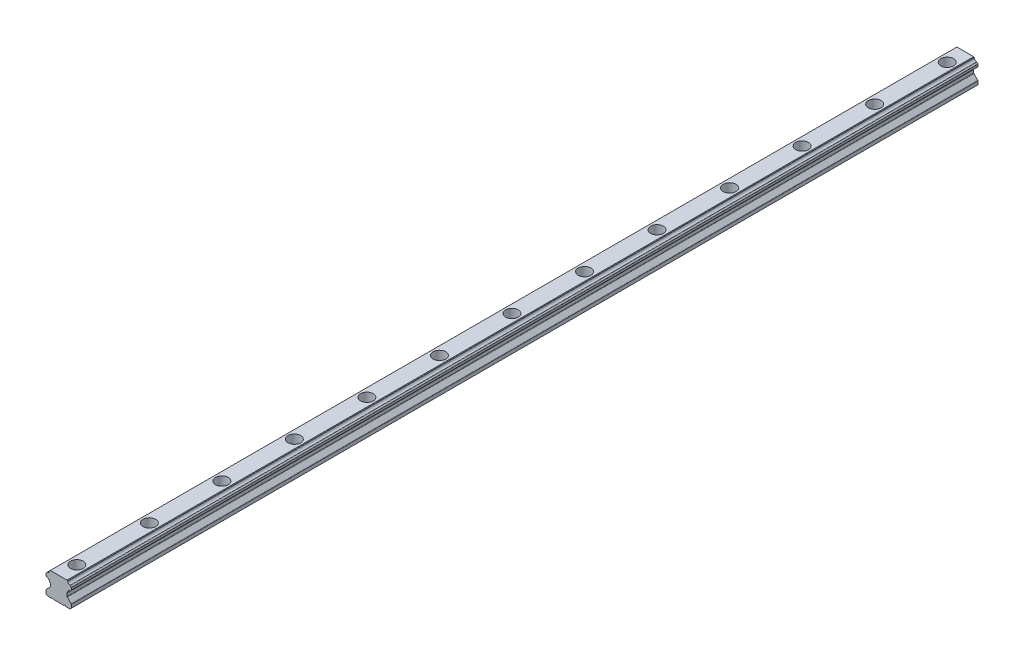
SolidWorks part; units mm, degrees
ref_plane "Front Plane" through (0, 0, 0) normal (0, 0, 1) x (1, 0, 0)
ref_plane "Top Plane" through (0, 0, 0) normal (0, 1, 0) x (1, 0, 0)
ref_plane "Right Plane" through (0, 0, 0) normal (1, 0, 0) x (0, 0, -1)
sketch "Sketch2" plane through (0, 0, 0) normal (0, 0, 1) x (1, 0, 0)
  line L0 (12.8558, 4.6786) -> (13.9571, 5.7799)
  line L1 (14.1328, 6.2042) -> (14.1328, 8.2246)
  line L2 (13.9571, 8.6489) -> (12.8494, 9.7566)
  line L3 (9.8814, 12.7246) -> (9.3887, 13.2173)
  line L4 (9.3887, 13.2173) -> (-9.123, 13.2173)
  line L5 (-9.123, 13.2173) -> (-9.6158, 12.7246)
  line L6 (-12.5837, 9.7566) -> (-13.6914, 8.6489)
  line L7 (-13.8672, 8.2246) -> (-13.8672, 6.2042)
  line L8 (-13.6914, 5.7799) -> (-12.5901, 4.6786)
  line L9 (-9.615, 1.7034) -> (-9.4015, 1.49)
  line L10 (-9.1672, 0.9243) -> (-9.1672, -2.3102)
  line L11 (-9.4015, -2.8759) -> (-13.6328, -7.1073)
  line L12 (-13.8672, -7.6729) -> (-13.8672, -11.2827)
  line L13 (-13.8672, -11.2827) -> (-12.3672, -12.7827)
  line L14 (-12.3672, -12.7827) -> (-7.6172, -12.7827)
  line L15 (-7.6172, -12.7827) -> (-7.1172, -12.2827)
  line L16 (-7.1172, -12.2827) -> (-5.9172, -12.2827)
  line L17 (-5.9172, -12.2827) -> (-5.4172, -12.7827)
  line L18 (-5.4172, -12.7827) -> (5.6828, -12.7827)
  line L19 (5.6828, -12.7827) -> (6.1828, -12.2827)
  line L20 (6.1828, -12.2827) -> (7.3828, -12.2827)
  line L21 (7.3828, -12.2827) -> (7.8828, -12.7827)
  line L22 (7.8828, -12.7827) -> (12.6328, -12.7827)
  line L23 (12.6328, -12.7827) -> (14.1328, -11.2827)
  line L24 (14.1328, -11.2827) -> (14.1328, -7.6729)
  line L25 (13.8985, -7.1073) -> (9.6672, -2.8759)
  line L26 (9.4328, -2.3102) -> (9.4328, 0.9243)
  line L27 (9.6672, 1.49) -> (9.8806, 1.7034)
  arc A0 (12.5064, 4.5076) -> (12.8558, 4.6786) centre (12.4315, 5.1029) ccw
  arc A1 (13.9571, 5.7799) -> (14.1328, 6.2042) centre (13.5328, 6.2042) ccw
  arc A2 (14.1328, 8.2246) -> (13.9571, 8.6489) centre (13.5328, 8.2246) ccw
  arc A3 (12.8494, 9.7566) -> (12.5011, 9.9275) centre (12.4251, 9.3323) ccw
  arc A4 (10.0523, 12.3763) -> (12.5011, 9.9275) centre (12.8596, 12.7347) ccw
  arc A5 (10.0523, 12.3763) -> (9.8814, 12.7246) centre (9.4572, 12.3003) ccw
  arc A6 (-9.6158, 12.7246) -> (-9.7867, 12.3763) centre (-9.1915, 12.3003) ccw
  arc A7 (-12.2354, 9.9275) -> (-9.7867, 12.3763) centre (-12.5939, 12.7347) ccw
  arc A8 (-12.2354, 9.9275) -> (-12.5837, 9.7566) centre (-12.1595, 9.3323) ccw
  arc A9 (-13.6914, 8.6489) -> (-13.8672, 8.2246) centre (-13.2672, 8.2246) ccw
  arc A10 (-13.8672, 6.2042) -> (-13.6914, 5.7799) centre (-13.2672, 6.2042) ccw
  arc A11 (-12.5901, 4.6786) -> (-12.2407, 4.5076) centre (-12.1659, 5.1029) ccw
  arc A12 (-9.786, 2.0528) -> (-12.2407, 4.5076) centre (-12.5939, 1.6997) ccw
  arc A13 (-9.786, 2.0528) -> (-9.615, 1.7034) centre (-9.1907, 2.1277) ccw
  arc A14 (-9.1672, 0.9243) -> (-9.4015, 1.49) centre (-9.9672, 0.9243) ccw
  arc A15 (-9.4015, -2.8759) -> (-9.1672, -2.3102) centre (-9.9672, -2.3102) ccw
  arc A16 (-13.6328, -7.1073) -> (-13.8672, -7.6729) centre (-13.0672, -7.6729) ccw
  arc A17 (14.1328, -7.6729) -> (13.8985, -7.1073) centre (13.3328, -7.6729) ccw
  arc A18 (9.4328, -2.3102) -> (9.6672, -2.8759) centre (10.2328, -2.3102) ccw
  arc A19 (9.6672, 1.49) -> (9.4328, 0.9243) centre (10.2328, 0.9243) ccw
  arc A20 (9.8806, 1.7034) -> (10.0517, 2.0528) centre (9.4564, 2.1277) ccw
  arc A21 (12.5064, 4.5076) -> (10.0517, 2.0528) centre (12.8596, 1.6997) ccw
extrude "Boss-Extrude1" add sketch "Sketch2" along normal blind 1000
sketch "Sketch3" plane through (0, 13.2173, 0) normal (0, 1, 0) x (1, 0, 0)
  line L0 (9.3887, 0) -> (-9.123, 0) construction
  line L1 (14.1328, -1000) -> (14.1328, 0) construction
  point P0 (0.1328, -20)
  dimension "D1" = 20
  dimension "D2" = 14
hole_wizard "CBORE for M16 Hex Head Bolt1" positions "Sketch3" profile "Sketch4" counterbore size "M16" standard "DIN"
sketch "Sketch4" plane through (0.1328, 13.2173, 20) normal (1, 0, 0) x (0, 0, 1)
  line L0 (0, 0) -> (0, 26)
  line L1 (0, 26) -> (4.5, 26)
  line L3 (4.5, 26) -> (4.5, 12)
  line L4 (4.5, 12) -> (7, 12)
  line L5 (7, 12) -> (7, 0)
  line L7 (7, 0) -> (0, 0)
  line L11 (0, -6.35) -> (0, 107.95) construction
  dimension "Thru Hole Dia." = 9
  dimension "Thru Hole Depth" = 26
  dimension "C'Bore Dia." = 14
  dimension "C'Bore Depth" = 12
other "Fill Pattern1" parameters "D5"=0, "D6"=0, "D1"=80, "D2"=60, "D3"=0, "D9"=13, "D7"=13, "D8"=2
